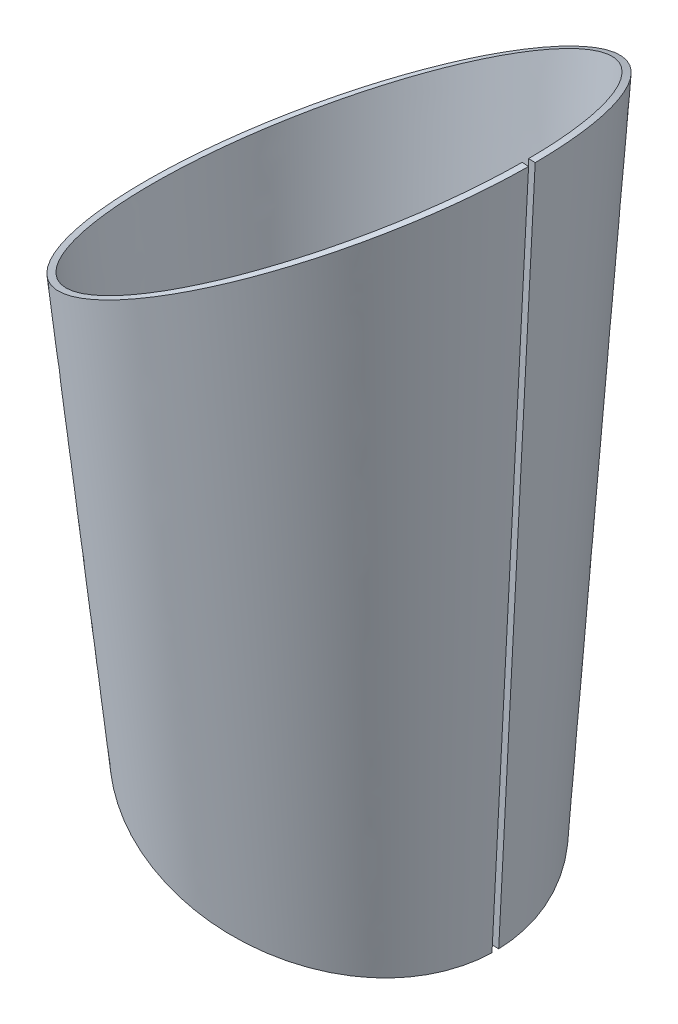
SolidWorks part; units mm, degrees
ref_plane "Ebene vorne" through (0, 0, 0) normal (0, 0, 1) x (1, 0, 0)
ref_plane "Ebene oben" through (0, 0, 0) normal (0, 1, 0) x (1, 0, 0)
ref_plane "Ebene rechts" through (0, 0, 0) normal (1, 0, 0) x (0, 0, -1)
sketch3d "3D-Skizze2"
  line L0 (0, 0, 0) -> (0, 160.6722, 0) construction
  line L1 (0, 0, 0) -> (69.6843, 0, 0) construction
  line L2 (0, 0, 0) -> (0, 0, 86.7442) construction
sketch "Skizze1" plane through (0, 0, 0) normal (0, 0, 1) x (1, 0, 0)
  line L0 (0, 41.4801) -> (0, 0) construction
  line L1 (0, 0) -> (47.0687, 0) construction
  line L2 (0, 41.4801) -> (5.2201, 32.0588) construction
  line L3 (0, 0) -> (5.2201, 13.0401) construction
ref_plane "Ebene1" through (0, 0, 0) normal (0.3716, 0.9284, 0) x (-0.9284, 0.3716, 0)
ref_plane "Ebene2" through (0, 41.4801, 0) normal (0.4847, -0.8747, 0) x (0.8747, 0.4847, 0)
sketch "Skizze2" plane through (0, 41.4801, 0) normal (0.4847, -0.8747, 0) x (0.8747, 0.4847, 0)
  line L0 (0, 0) -> (16.5, 0) construction
  arc A0 (16.4981, 0.25) -> (16.4981, -0.25) centre (0, 0) ccw
  circle A1 centre (16.5, 0) radius 0.25 construction
  dimension "D1" = 33
  dimension "D2" = 0.5
sketch "Skizze3" plane through (0, 0, 0) normal (0.3716, 0.9284, 0) x (-0.9284, 0.3716, 0)
  line L0 (0, 0) -> (-12.5, 0) construction
  arc A0 (-12.4975, -0.25) -> (-12.4975, 0.25) centre (0, 0) ccw
  circle A1 centre (-12.5, 0) radius 0.25 construction
  dimension "D1" = 25
  dimension "D2" = 0.5
sheet metal parameters "Blech1" thickness 0.5 parameters "D1"=1, "Dicke"=0.5
lofted bend "Ausgeformte Biegungen1" parameters "D1"=0, "D12"=0.5
other "Freiform-Biegung1" parameters "D1"=1000, "D4"=57.296, "D5"=1
sketch "Skizze5" plane through (0, 0, 0) normal (0.3716, 0.9284, 0) x (-0.9284, 0.3716, 0)
  arc A0 (-12.4975, -0.25) -> (-12.4975, 0.25) centre (0, 0) ccw construction
  arc A1 (-12.4975, -0.25) -> (-12.4975, 0.25) centre (0, 0) ccw
sketch3d "3D-Skizze1"
  line L0 (0, 0, 0) -> (-17.8342, -30.4954, 20.5885) construction
  line L1 (0, 0, 0) -> (0, 0, 86.7442) construction
  line L2 (0, 0, 0) -> (69.6843, 0, 0) construction
  dimension "D1" = 59.767
  dimension "D2" = 115.859
ref_plane "Ebene3" through (-17.8342, -30.4954, 20.5885) normal (-0.4362, -0.7458, 0.5035) x (0.8999, -0.3615, 0.2441)
sketch "Skizze6" plane through (-17.8342, -30.4954, 20.5885) normal (-0.4362, -0.7458, 0.5035) x (0.8999, -0.3615, 0.2441)
  line L0 (0, 0) -> (28.5897, 0) construction
  line L1 (0, 0) -> (0, -23.951) construction
  arc A0 (14.9979, 0.25) -> (14.9979, -0.25) centre (0, 0) ccw
  circle A1 centre (15, 0) radius 0.25 construction
  dimension "D1" = 30
  dimension "D2" = 0.5
delete or keep bodies "Körper-Löschen1" [suppressed] bodies 103
lofted bend "Ausgeformte Biegungen2" parameters "D1"=0, "D12"=0.5
other "Freiform-Biegung2" [suppressed] parameters "D1"=1000, "D4"=57.296, "D5"=2
flat pattern "Abwicklung1"
sketch "Biegung-Linien1" plane through (0, 0, 0) normal (0, 1, 0) x (-1, 0, 0)
other "Abwickeln-<Freiform-Biegung1>1"
other "Abwickeln-<Freiform-Biegung2>1" [suppressed]
equation "\"Radius\"=0"
equation "\"Stückzahl\"= 1"
